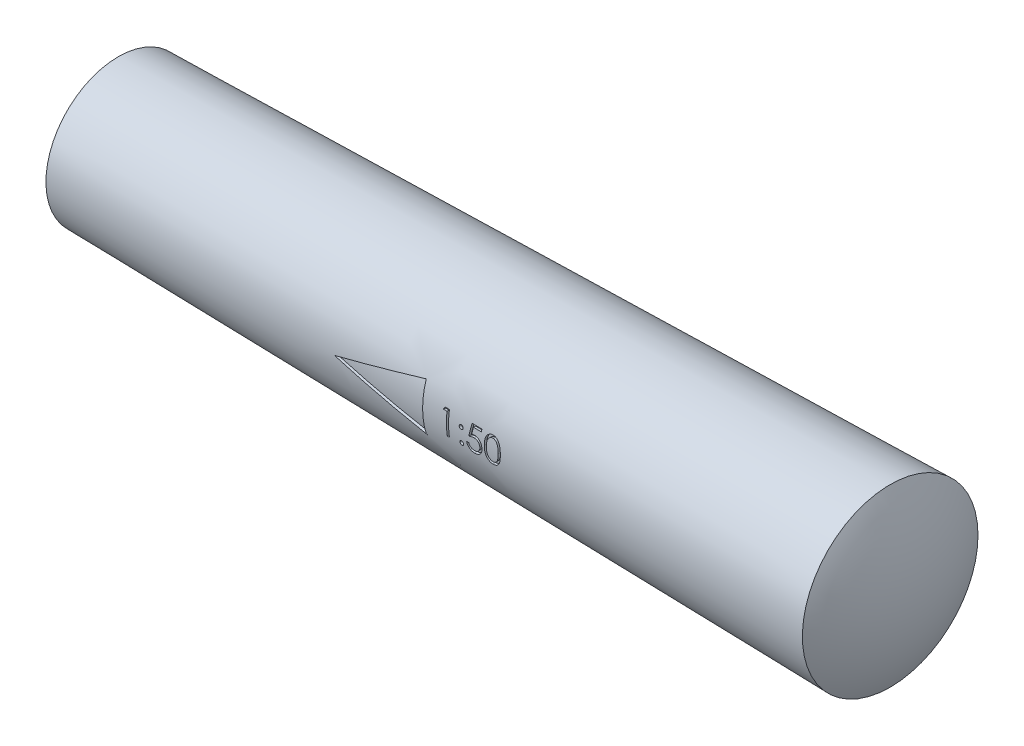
SolidWorks part; units mm, degrees
ref_plane "Front Plane" through (0, 0, 0) normal (0, 0, 1) x (1, 0, 0)
ref_plane "Top Plane" through (0, 0, 0) normal (0, 1, 0) x (1, 0, 0)
ref_plane "Right Plane" through (0, 0, 0) normal (1, 0, 0) x (0, 0, -1)
sketch "Sketch1" plane through (0, 0, 0) normal (1, 0, 0) x (0, 0, -1)
  circle A0 centre (0, 0) radius 3
  dimension "D1" = 6
extrude "Extrude1" add sketch "Sketch1" along normal mid plane 32
draft "Draft1" type of draft neutral plane draft angle 1.146 faces to draft 1 parameters "D1"=1.146
sketch "Sketch2" plane through (0, 0, 0) normal (0, 0, 1) x (1, 0, 0)
  line L0 (-16, 0) -> (-16, 3)
  line L1 (-16, 3) -> (-16, -3) construction
  line L2 (-16, 0) -> (-16.9, 0)
  line L3 (-16.9, 0) -> (-16.9, -3.32) construction
  line L4 (16, 0) -> (16, 3.64)
  line L5 (16, -3.64) -> (16, 3.64) construction
  line L6 (16, 0) -> (16.9, 0)
  line L7 (16.9, 0) -> (16.9, -3.32) construction
  line L8 (-16, -3) -> (16, -3.64) construction
  arc A0 (-16.9, 0) -> (-16, 3) centre (-11.45, 0) cw
  arc A1 (16.9, 0) -> (16, 3.64) centre (9.089, 0) ccw
  point P14 (0, -3.32)
revolve "Revolve1" add sketch "Sketch2" angle 360 about L2
sketch "Sketch5" plane through (0, 0, 0) normal (0, 0, 1) x (1, 0, 0)
  line L0 (0, 3.32) -> (0, -3.32) construction
  line L1 (16, 3.64) -> (-16, 3) construction
  line L2 (-16, -3) -> (16, -3.64) construction
ref_plane "Plane2" through (0, 0, 0) normal (-0.02, 0, 0.9998) x (0.9998, 0, 0.02)
sketch "Sketch6" plane through (0, 0, 0) normal (-0.02, 0, 0.9998) x (0.9998, 0, 0.02)
  line L0 (0, 0) -> (0, 1)
  line L1 (0, 3.32) -> (0, -3.32) construction
  line L2 (0, 1) -> (-3.7321, 0)
  line L3 (-3.7321, 0) -> (0, -1)
  line L4 (0, -1) -> (0, 0)
  line L5 (0, -0.5) -> (4, -0.5) construction
  text T0 "1:50" font "Century Gothic" height 1
  dimension "D1" = 2
  dimension "D2" = 30
  dimension "D3" = 4
wrap "Wrap2" sketch "Sketch6" wrap type deboss source sketch "Sketch6" thickness 0.1 parameters "D1"=0.1
equation "\"D2@Sketch2\" = \"D1@Sketch2\""
